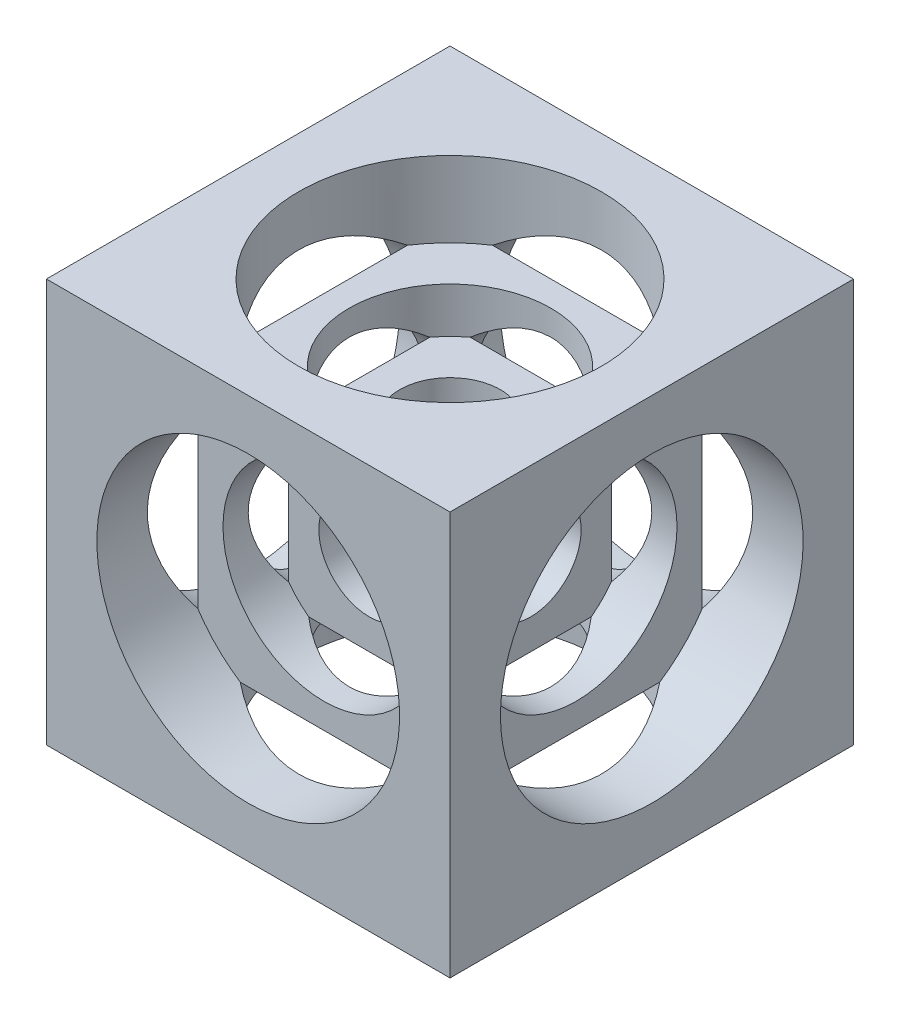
SolidWorks part; units mm, degrees
ref_plane "Front Plane" through (0, 0, 0) normal (0, 0, 1) x (1, 0, 0)
ref_plane "Top Plane" through (0, 0, 0) normal (0, 1, 0) x (1, 0, 0)
ref_plane "Right Plane" through (0, 0, 0) normal (1, 0, 0) x (0, 0, -1)
sketch "Sketch1" plane through (0, 0, 0) normal (0, 1, 0) x (1, 0, 0)
  line L1 (0, 0) -> (25.4, 0)
  line L2 (0, 0) -> (0, 25.4)
  line L3 (0, 25.4) -> (25.4, 25.4)
  line L4 (25.4, 0) -> (25.4, 25.4)
  dimension "D1" = 25.4
  dimension "D2" = 25.4
extrude "Boss-Extrude2" add sketch "Sketch1" along normal blind 25.4
sketch "Sketch2" plane through (0, 25.4, 0) normal (0, 1, 0) x (1, 0, 0)
  line L0 (0, 25.4) -> (25.4, 0) construction
sketch "Sketch3" plane through (0, 0, 0) normal (0, 0, 1) x (1, 0, 0)
  line L0 (0, 25.4) -> (25.4, 0) construction
sketch "Sketch4" plane through (25.4, 0, 0) normal (1, 0, 0) x (0, 0, -1)
  line L0 (0, 25.4) -> (25.4, 0) construction
sketch "Sketch5" plane through (0, 25.4, 0) normal (0, 1, 0) x (1, 0, 0)
  line L1 (0, 25.4) -> (25.4, 0) construction
  circle A0 centre (12.7, 12.7) radius 3.175
extrude "Cut-Extrude2" cut sketch "Sketch5" against normal through all
sketch "Sketch6" plane through (0, 0, 0) normal (0, 0, 1) x (1, 0, 0)
  line L0 (0, 25.4) -> (25.4, 0) construction
  circle A0 centre (12.7, 12.7) radius 3.175
extrude "Cut-Extrude3" cut sketch "Sketch6" against normal through all
sketch "Sketch7" plane through (25.4, 0, 0) normal (1, 0, 0) x (0, 0, -1)
  line L0 (0, 25.4) -> (25.4, 0) construction
  circle A0 centre (12.7, 12.7) radius 3.175
extrude "Cut-Extrude4" cut sketch "Sketch7" against normal through all
sketch "Sketch8" plane through (0, 25.4, 0) normal (0, 1, 0) x (1, 0, 0)
  circle A0 centre (12.7, 12.7) radius 6.35
extrude "Cut-Extrude5" cut sketch "Sketch8" against normal blind 7.62
sketch "Sketch9" plane through (0, 25.4, 0) normal (0, 1, 0) x (1, 0, 0)
  circle A0 centre (12.7, 12.7) radius 9.525
extrude "Cut-Extrude6" cut sketch "Sketch9" against normal blind 4.7625
pattern_circular "CirPattern1" count 4 over 360 about axis through (12.7, 12.7, 0) along (0, 0, 1) of "Cut-Extrude2", "Cut-Extrude5", "Cut-Extrude6"
pattern_circular "CirPattern2" count 2 over 90 about axis through (0, 12.7, -12.7) along (1, 0, 0) of "Cut-Extrude5", "Cut-Extrude2", "Cut-Extrude6"
pattern_circular "CirPattern3" count 2 over 90 about axis through (0, 12.7, -12.7) along (1, 0, 0) of "Cut-Extrude2", "Cut-Extrude5", "Cut-Extrude6"
sketch3d "3DSketch1"
  line L0 (0, 25.4, 0) -> (25.4, 0, -25.4) construction
